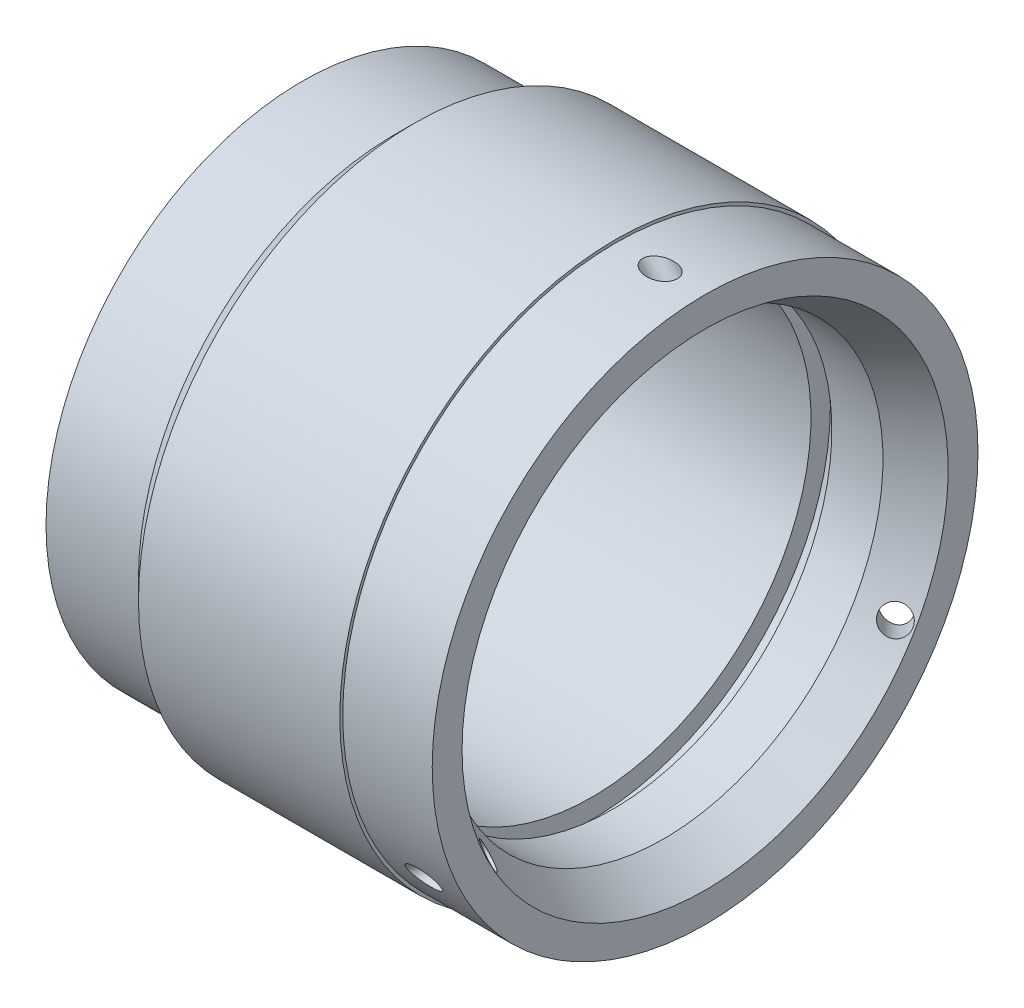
SolidWorks part; units mm, degrees
ref_plane "Plan de Face" through (0, 0, 0) normal (0, 0, 1) x (1, 0, 0)
ref_plane "Plan de Dessus" through (0, 0, 0) normal (0, 1, 0) x (1, 0, 0)
ref_plane "Plan de Droite" through (0, 0, 0) normal (1, 0, 0) x (0, 0, -1)
sketch "Esquisse1" plane through (0, 0, 0) normal (0, 0, 1) x (1, 0, 0)
  line L0 (0, 8.6) -> (0, 8.05)
  line L1 (0, 8.6) -> (3.1, 8.6)
  line L2 (3.1, 8.6) -> (3.75, 9.25)
  line L3 (3.75, 9.25) -> (10.5, 9.25)
  line L4 (10.5, 9.25) -> (10.5, 9.15)
  line L5 (13.5, 9.15) -> (10.5, 9.15)
  line L6 (10.4, 7.35) -> (12.1144, 7.35)
  line L8 (13.5, 9.15) -> (13.5, 8.15)
  line L10 (10.4, 7.35) -> (10.4, 8)
  line L11 (10.4, 8) -> (9.7, 8)
  line L12 (9.7, 8) -> (9.7, 7.35)
  line L13 (13.5, 8.15) -> (12.1144, 7.35)
  line L17 (9.7, 7.35) -> (0.8041, 7.35)
  line L18 (0.8041, 7.35) -> (0.4, 8.05)
  line L19 (0.4, 8.05) -> (0, 8.05)
  line L20 (0, 0) -> (3.3614, 0) construction
  dimension "D1" = 17.2
  dimension "D2" = 18.5
  dimension "D3" = 18.3
  dimension "D4" = 16
  dimension "D5" = 16.1
  dimension "D6" = 14.7
  dimension "D7" = 13.5
  dimension "D8" = 3.1
  dimension "D9" = 45
  dimension "D11" = 3
  dimension "D13" = 0.4
  dimension "D15" = 1
  dimension "D16" = 30
  dimension "D17" = 0.7
  dimension "D18" = 60
  dimension "D20" = 3.1
revolve "Révolution1" add sketch "Esquisse1" angle 360 about L20
sketch "Esquisse2" plane through (0, 0, 0) normal (0, 0, 1) x (1, 0, 0)
  line L0 (13.5, 7.35) -> (15.1839, 5.3432) construction
  line L1 (0, 0) -> (14.0776, 0) construction
  line L2 (13.5, -9.15) -> (13.5, 9.15) construction
  dimension "D1" = 14.7
  dimension "D2" = 50
ref_plane "Plan2" through (15.1839, 5.3432, 0) normal (0.6428, -0.766, 0) x (0, 0, -1)
sketch "Esquisse4" plane through (15.1839, 5.3432, 0) normal (0.6428, -0.766, 0) x (0, 0, -1)
  circle A0 centre (0, 0) radius 0.45
  dimension "D1" = 0.9
extrude "Extrusion1" cut sketch "Esquisse4" against normal through all
pattern_circular "Répétition circulaire1" count 3 over 360 of "Extrusion1"
